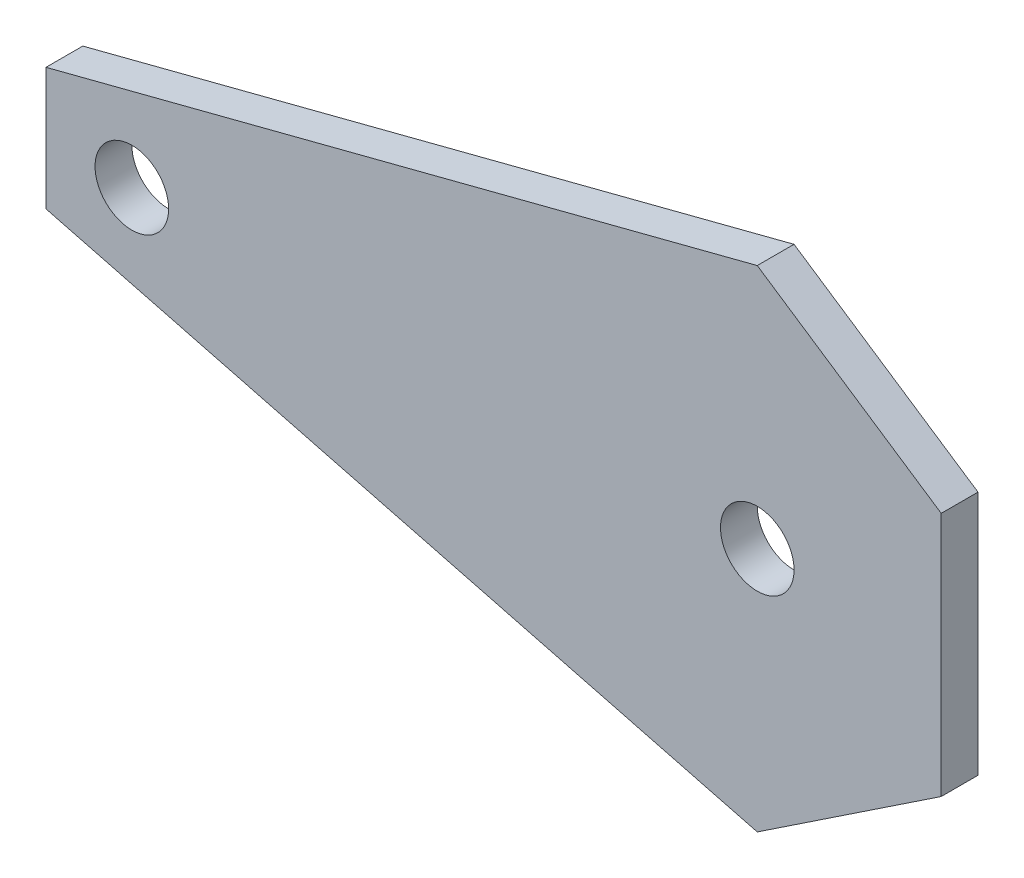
SolidWorks part; units mm, degrees
ref_plane "Front Plane" through (0, 0, 0) normal (0, 0, 1) x (1, 0, 0)
ref_plane "Top Plane" through (0, 0, 0) normal (0, 1, 0) x (1, 0, 0)
ref_plane "Right Plane" through (0, 0, 0) normal (1, 0, 0) x (0, 0, -1)
sketch "Sketch1" plane through (0, 0, 0) normal (0, 0, 1) x (1, 0, 0)
  line L0 (15, 10) -> (15, -10)
  line L1 (15, -10) -> (0, -20)
  line L2 (0, -20) -> (-58, -5)
  line L3 (-58, -5) -> (-58, 5)
  line L4 (-58, 5) -> (0, 20)
  line L5 (0, 20) -> (15, 10)
  line L6 (-58, 0) -> (15, 0) construction
  line L7 (0, 20) -> (0, -20) construction
  circle A0 centre (0, 0) radius 3
  circle A1 centre (-48, 0) radius 3 construction
  circle A2 centre (-51, 0) radius 6 construction
  circle A3 centre (-51, 0) radius 3
  point P13 (0, 0)
  dimension "D1" = 6
  dimension "D7" = 6
  dimension "D9" = 12
  dimension "D10" = 6
  dimension "D2" = 48
  dimension "D3" = 15
  dimension "D4" = 20
  dimension "D5" = 10
  dimension "D6" = 40
  dimension "D8" = 10
extrude "Boss-Extrude1" add sketch "Sketch1" along normal blind 3
